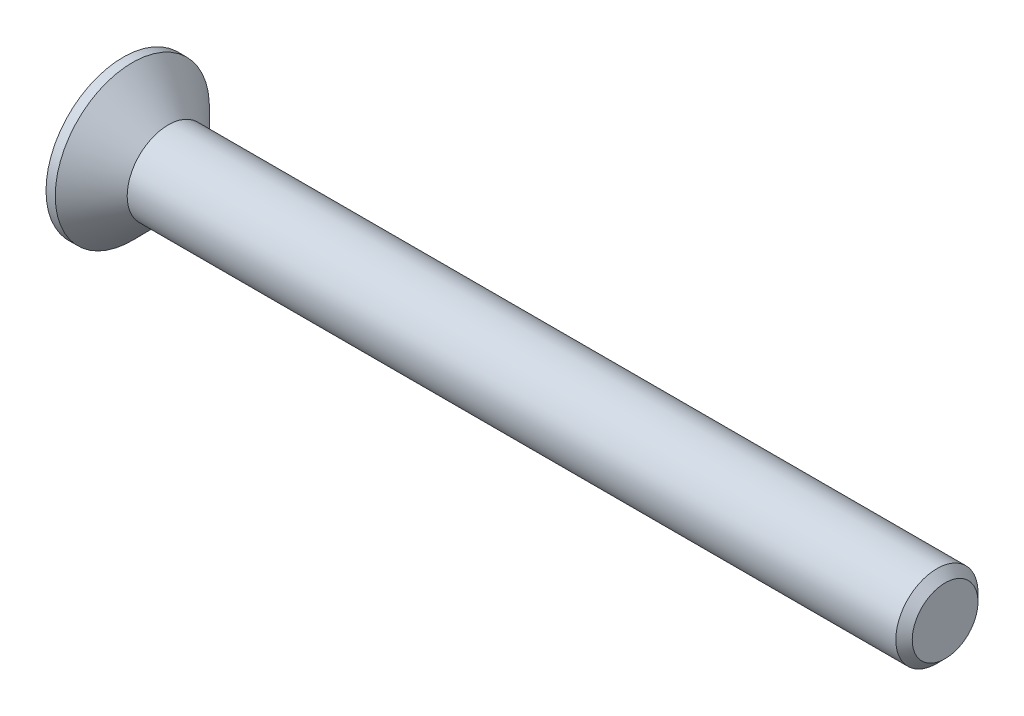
SolidWorks part; units mm, degrees
ref_plane "Front Plane" through (0, 0, 0) normal (0, 0, 1) x (1, 0, 0)
ref_plane "Top Plane" through (0, 0, 0) normal (0, 1, 0) x (1, 0, 0)
ref_plane "Right Plane" through (0, 0, 0) normal (1, 0, 0) x (0, 0, -1)
sketch "Sketch1" plane through (0, 0, 0) normal (0, 0, 1) x (1, 0, 0)
  line L1 (-2.2, 3.75) -> (-2.2, 0)
  line L2 (-2.2, 0) -> (37.8, 0)
  line L3 (37.8, 0) -> (37.8, 2)
  line L4 (37.8, 2) -> (0, 2)
  line L5 (-2.2, 3.75) -> (-1.75, 3.75)
  line L6 (-1.75, 3.75) -> (0, 2)
  dimension "D1" = 2
  dimension "D2" = 45
  dimension "D3" = 2.2
  dimension "D4" = 40
  dimension "D5" = 3.75
revolve "Revolve1" add sketch "Sketch1" angle 360 about L2
chamfer "Chamfer1" distance 0.4 angle 45 1 edges at (37.8, 0, 2)
sketch "Sketch2" plane through (-2.2, 0, 0) normal (-1, 0, 0) x (0, 0, 1)
  line L0 (-0.55, 2.2) -> (0.55, 2.2)
  line L1 (0.55, 2.2) -> (0.55, 0.55)
  line L2 (0.55, 0.55) -> (2.2, 0.55)
  line L3 (2.2, 0.55) -> (2.2, -0.55)
  line L4 (2.2, -0.55) -> (0.55, -0.55)
  line L5 (0.55, -0.55) -> (0.55, -2.2)
  line L6 (0.55, -2.2) -> (-0.55, -2.2)
  line L7 (-0.55, -2.2) -> (-0.55, -0.55)
  line L8 (-0.55, -0.55) -> (-2.2, -0.55)
  line L9 (-2.2, -0.55) -> (-2.2, 0.55)
  line L10 (-2.2, 0.55) -> (-0.55, 0.55)
  line L11 (-0.55, 0.55) -> (-0.55, 2.2)
  point P2 (0, 2.2)
  point P14 (0, -2.2)
  point P15 (2.2, 0)
  point P16 (-2.2, 0)
  dimension "D1" = 4.4
  dimension "D2" = 1.1
extrude "Cut-Extrude1" cut sketch "Sketch2" against normal blind 1.9
